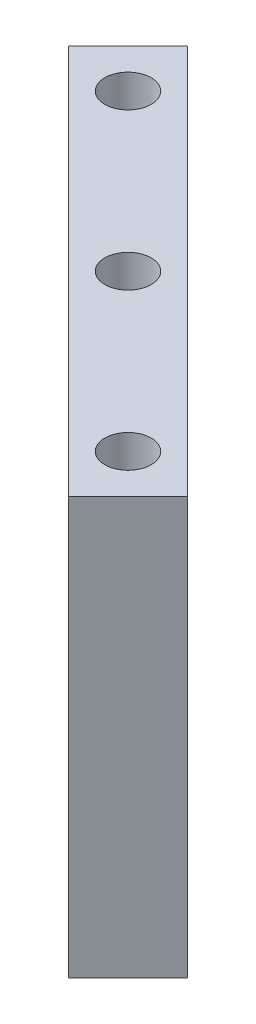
SolidWorks part; units mm, degrees
ref_plane "前视基准面" through (0, 0, 0) normal (0, 0, 1) x (1, 0, 0)
ref_plane "上视基准面" through (0, 0, 0) normal (0, 1, 0) x (1, 0, 0)
ref_plane "右视基准面" through (0, 0, 0) normal (1, 0, 0) x (0, 0, -1)
other "Configuration Table"
sketch "草图1" plane through (0, 0, 0) normal (0, 1, 0) x (1, 0, 0)
  line L0 (458.5965, -465.6676) -> (465.6676, -458.5965) construction
  line L1 (0, 0) -> (250, 0) construction
  line L2 (0, 0) -> (0, -250) construction
  line L3 (0, -250) -> (250, -250) construction
  line L4 (250, 0) -> (250, -250) construction
  line L5 (458.5965, -465.6676) -> (34.3324, -41.4035) construction
  line L6 (465.6676, -458.5965) -> (41.4035, -34.3324) construction
  line L7 (34.3324, -41.4035) -> (41.4035, -34.3324) construction
  line L8 (458.5965, -465.6676) -> (41.4035, -34.3324) construction
  line L9 (465.6676, -458.5965) -> (34.3324, -41.4035) construction
  line L10 (8, -43) -> (8, -13) construction
  line L11 (13, -8) -> (43, -8) construction
  line L12 (47.4774, -10.7746) -> (76.7588, -69.6878) construction
  line L13 (76.7588, -69.6878) -> (69.6878, -76.7588) construction
  line L14 (69.6878, -76.7588) -> (10.7746, -47.4774) construction
  line L15 (49.1817, -61.9096) -> (37.868, -50.5959) construction
  line L16 (35.181, -40.555) -> (40.555, -35.181)
  line L17 (35.181, -40.555) -> (70.5363, -75.9103)
  line L18 (40.555, -35.181) -> (75.9103, -70.5363)
  line L19 (70.5363, -75.9103) -> (75.9103, -70.5363)
  line L20 (35.181, -40.555) -> (75.9103, -70.5363) construction
  line L21 (40.555, -35.181) -> (70.5363, -75.9103) construction
  arc A0 (43, -8) -> (47.4774, -10.7746) centre (43, -13) cw construction
  arc A1 (8, -43) -> (10.7746, -47.4774) centre (13, -43) ccw construction
  arc A2 (8, -13) -> (13, -8) centre (13, -13) cw construction
  circle A3 centre (13, -13) radius 2.1 construction
  circle A4 centre (43, -13) radius 2.1 construction
  circle A5 centre (28, -13) radius 1.6 construction
  circle A6 centre (13, -43) radius 2.1 construction
  circle A7 centre (13, -28) radius 1.6 construction
  circle A8 centre (41.4035, -41.4035) radius 2.1
  circle A9 centre (55.5456, -55.5456) radius 2.1
  circle A10 centre (69.6878, -69.6878) radius 2.1
  circle A11 centre (49.1817, -61.9096) radius 1.6 construction
  circle A12 centre (37.868, -50.5959) radius 1.6 construction
  circle A13 centre (26.5543, -39.2822) radius 1.6 construction
  circle A14 centre (50.5959, -37.868) radius 1.6 construction
  circle A15 centre (39.2822, -26.5543) radius 1.6 construction
  circle A16 centre (61.9096, -49.1817) radius 1.6 construction
  point P30 (46.0984, -8)
  point P33 (8, -46.0984)
  point P36 (8, -8)
  dimension "D11" = 5
  dimension "D12" = 4.2
  dimension "D16" = 4.2
  dimension "D26" = 3.2
  dimension "D1" = 250
  dimension "D2" = 250
  dimension "D3" = 10
  dimension "D4" = 45
  dimension "D5" = 600
  dimension "D6" = 8
  dimension "D7" = 8
  dimension "D8" = 30
  dimension "D9" = 30
  dimension "D10" = 50
  dimension "D13" = 15
  dimension "D14" = 15
  dimension "D15" = 3
  dimension "D17" = 5
  dimension "D18" = 5
  dimension "D19" = 20
  dimension "D22" = 16
  dimension "D23" = 25
  dimension "D24" = 4
  dimension "D25" = 4
  dimension "D27" = 25
  dimension "D28" = 1.2
  dimension "D20" = 3
  dimension "D21" = 2
extrude "凸台-拉伸1" add sketch "草图1" along normal blind 37.8
